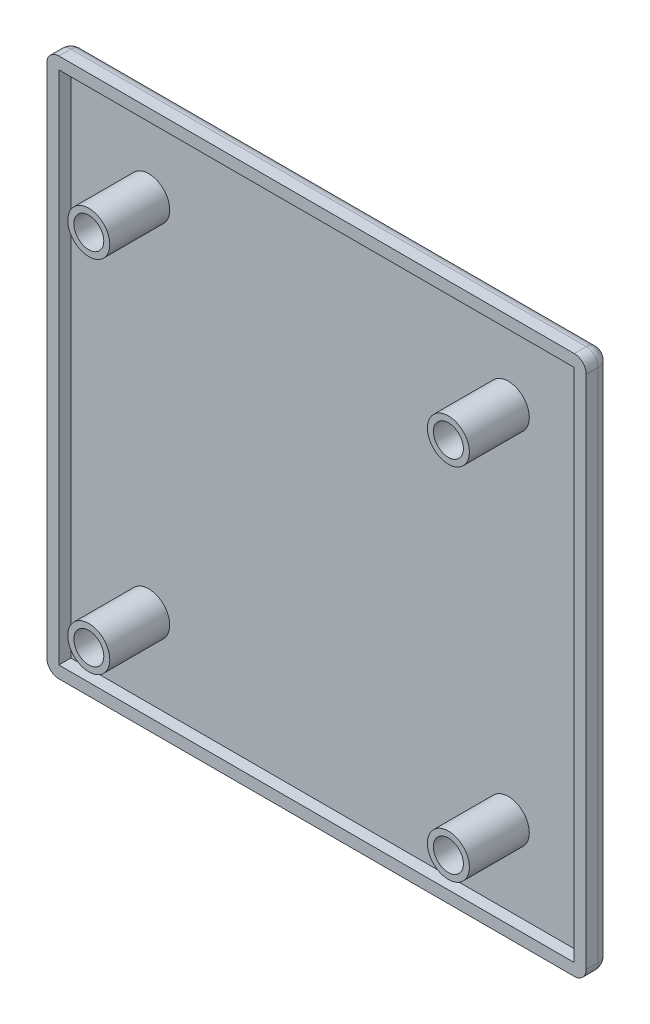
SolidWorks part; units mm, degrees
ref_plane "前视基准面" through (0, 0, 0) normal (0, 0, 1) x (1, 0, 0)
ref_plane "上视基准面" through (0, 0, 0) normal (0, 1, 0) x (1, 0, 0)
ref_plane "右视基准面" through (0, 0, 0) normal (1, 0, 0) x (0, 0, -1)
sketch "草图2" plane through (0, 0, 0) normal (0, 0, 1) x (1, 0, 0)
  line L1 (-45, 45) -> (45, 45)
  line L2 (-45, 45) -> (-45, -45)
  line L3 (-45, -45) -> (45, -45)
  line L4 (45, 45) -> (45, -45)
  dimension "D1" = 90
  dimension "D2" = 90
  dimension "D3" = 45
extrude "凸台-拉伸1" add sketch "草图2" along normal mid plane 4
shell "抽壳1" thickness 2
fillet "圆角1" radius 2 8 edges at (-45, 45, 0) (-45, -45, 0) (-45, 0, -2) (0, -45, -2) (45, -45, 0) (45, 0, -2) (0, 45, -2) (45, 45, 0)
sketch "草图3" plane through (0, 0, 0) normal (0, 0, 1) x (1, 0, 0)
  line L6 (45, -43) -> (45, 43) construction
  line L7 (-43, -45) -> (43, -45) construction
  line L8 (-45, 43) -> (-45, -43) construction
  circle A0 centre (-30, 30) radius 3.5
  circle A1 centre (-30, 30) radius 2.5
  circle A2 centre (30, 30) radius 3.5
  circle A3 centre (30, 30) radius 2.5
  circle A4 centre (30, -30) radius 3.5
  circle A5 centre (30, -30) radius 2.5
  circle A6 centre (-30, -30) radius 3.5
  circle A7 centre (-30, -30) radius 2.5
  dimension "D1" = 7
  dimension "D2" = 5
  dimension "D3" = 15
  dimension "D4" = 15
  dimension "D5" = 15
  dimension "D6" = 15
  dimension "D7" = 15
extrude "凸台-拉伸2" add sketch "草图3" along normal blind 10
